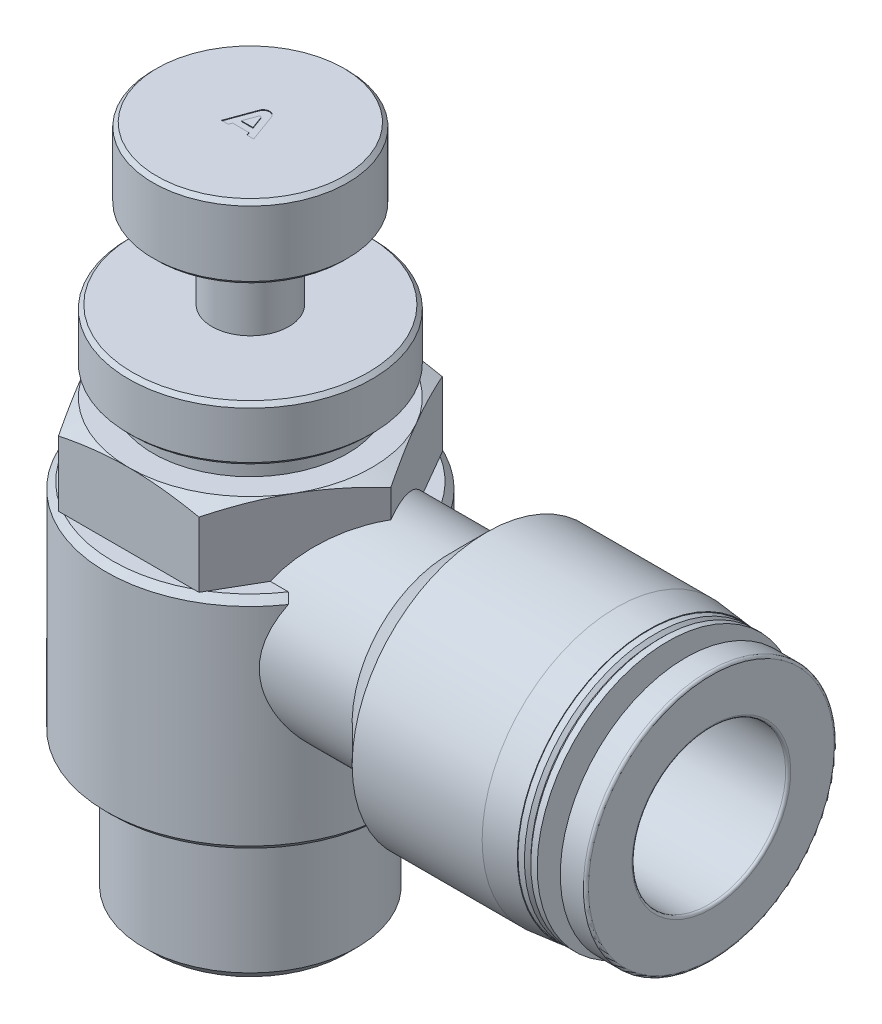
SolidWorks part; units mm, degrees
ref_plane "前视基准面" through (0, 0, 0) normal (0, 0, 1) x (1, 0, 0)
ref_plane "上视基准面" through (0, 0, 0) normal (0, 1, 0) x (1, 0, 0)
ref_plane "右视基准面" through (0, 0, 0) normal (1, 0, 0) x (0, 0, -1)
sketch "草图1" plane through (0, 0, 0) normal (0, 0, 1) x (1, 0, 0)
  line L0 (0, -23.5) -> (-7.475, -23.5)
  line L1 (-7.475, -23.5) -> (-8.331, -22.644)
  line L2 (-8.331, -22.644) -> (-8.331, -12.5)
  line L3 (-8.331, -12.5) -> (-10.75, -12.5)
  line L4 (-10.75, -12.5) -> (-11.25, -12)
  line L5 (-11.25, -12) -> (-11.25, 4.2)
  line L6 (-11.25, 4.2) -> (-10.75, 4.7)
  line L7 (-10.75, 4.7) -> (-10.9697, 4.7)
  line L8 (-10.9697, 4.7) -> (-10.9697, 9.7912)
  line L9 (-10.9697, 9.7912) -> (-9.5, 10.4)
  line L10 (-9.5, 10.4) -> (-7.6, 10.4)
  line L11 (-7.6, 10.4) -> (-7.6, 11.6)
  line L12 (-7.6, 11.6) -> (-7.3, 11.9)
  line L13 (-7.3, 11.9) -> (-3, 11.9)
  line L14 (-3, 11.9) -> (-3, 12.4)
  line L15 (-3, 12.4) -> (-9.2, 12.4)
  line L16 (-9.2, 12.4) -> (-9.5, 12.7)
  line L17 (-9.5, 12.7) -> (-9.5, 16.375)
  line L18 (-9.5, 16.375) -> (-9.2, 16.675)
  line L19 (-9.2, 16.675) -> (-3, 16.675)
  line L20 (-3, 16.675) -> (-3, 22.9935)
  line L21 (-3, 22.9935) -> (-2.6935, 23.3)
  line L22 (-2.6935, 23.3) -> (-7.3, 23.3)
  line L23 (-7.3, 23.3) -> (-7.6, 23.6)
  line L24 (-7.6, 23.6) -> (-7.6, 28.7)
  line L25 (-7.6, 28.7) -> (-7.3, 29)
  line L26 (-7.3, 29) -> (0, 29)
  line L27 (0, 29) -> (0, -23.5)
  line L28 (0, 29) -> (0, -23.5) construction
revolve "旋转1" add sketch "草图1" angle 360 about L28
ref_plane "基准面1" through (0, 4.7, 0) normal (0, 1, 0) x (1, 0, 0)
sketch "草图2" plane through (0, 4.7, 0) normal (0, 1, 0) x (1, 0, 0)
  line L0 (-10.9697, 0) -> (-5.4848, -9.5)
  line L1 (-5.4848, -9.5) -> (5.4848, -9.5)
  line L2 (5.4848, -9.5) -> (10.9697, 0)
  line L3 (10.9697, 0) -> (5.4848, 9.5)
  line L4 (5.4848, 9.5) -> (-5.4848, 9.5)
  line L5 (-5.4848, 9.5) -> (-10.9697, 0)
  circle A0 centre (0, 0) radius 19
extrude "切除-拉伸1" cut sketch "草图2" along normal blind 5.7
sketch "草图3" plane through (0, 0, 0) normal (0, 0, 1) x (1, 0, 0)
  line L0 (0, 7.6) -> (0, 4)
  line L1 (0, 4) -> (13, 4)
  line L2 (13, 4) -> (13, 6)
  line L3 (13, 6) -> (35.8, 6)
  line L4 (36, 6.2) -> (36, 9.6)
  line L5 (35.8, 9.8) -> (34, 9.8)
  line L6 (34, 9.8) -> (34, 6.9)
  line L7 (34, 6.9) -> (32.6, 6.9)
  line L8 (32.6, 6.9) -> (32.6, 10.2)
  line L9 (32.6, 10.2) -> (32.1, 10.2)
  line L10 (32.1, 10.2) -> (31.85, 9.95)
  line L11 (31.85, 9.95) -> (31.6, 10.2)
  line L12 (31.6, 10.2) -> (31.1, 10.2)
  line L13 (31.1, 10.2) -> (31.1, 10.25)
  line L14 (31.1, 10.25) -> (28.6, 10.5)
  line L15 (28.6, 10.5) -> (18.4497, 10.5)
  line L16 (18.4497, 10.5) -> (15.5497, 7.6)
  line L17 (15.5497, 7.6) -> (0, 7.6)
  line L18 (36, 0) -> (0, 0) construction
  arc A0 (35.8, 6) -> (36, 6.2) centre (35.8, 6.2) ccw
  arc A1 (36, 9.6) -> (35.8, 9.8) centre (35.8, 9.6) ccw
revolve "旋转2" add sketch "草图3" angle 360 about L18
sketch "草图4" plane through (0, 0, 0) normal (0, 0, 1) x (1, 0, 0)
  line L0 (0, -23.5) -> (-4.4655, -23.5)
  line L1 (-4.1655, -23.2) -> (-4.1655, 0)
  line L2 (-4.1655, 0) -> (-2.777, 0)
  line L3 (-2.777, 0) -> (-2.777, 2.777)
  line L4 (0, 5.554) -> (0, -23.5)
  line L5 (0, 5.554) -> (0, -23.5) construction
  arc A0 (-4.4655, -23.5) -> (-4.1655, -23.2) centre (-4.4655, -23.2) ccw
  arc A1 (-2.777, 2.777) -> (0, 5.554) centre (0, 2.777) cw
revolve "切除-旋转1" cut sketch "草图4" angle 360 about L5
sketch "草图5" plane through (0, 0, 0) normal (0, 0, 1) x (1, 0, 0)
  line L0 (0, 0) -> (0, 4)
  line L1 (0, 4) -> (13, 4)
  line L2 (13, 4) -> (13, 6)
  line L3 (13, 6) -> (36, 6)
  line L4 (36, 6) -> (36, 0)
  line L5 (36, 0) -> (0, 0)
  line L6 (36, 0) -> (0, 0) construction
revolve "切除-旋转2" cut sketch "草图5" angle 360 about L6
ref_plane "基准面2" through (0, 29, 0) normal (0, 1, 0) x (1, 0, 0)
sketch "草图6" plane through (0, 29, 0) normal (0, 1, 0) x (1, 0, 0)
  line L0 (-1.26, -1) -> (-0.7279, -1)
  line L1 (-0.7279, -1) -> (-0.6369, -0.75)
  line L2 (-0.6369, -0.75) -> (0.6369, -0.75)
  line L3 (0.6369, -0.75) -> (0.7279, -1)
  line L4 (0.7279, -1) -> (1.26, -1)
  line L5 (1.26, -1) -> (0.4698, 1.171)
  line L6 (-0.4698, 1.171) -> (-1.26, -1)
  line L7 (-0.455, -0.25) -> (0.455, -0.25)
  line L8 (0.455, -0.25) -> (0.094, 0.7418)
  line L9 (-0.094, 0.7418) -> (-0.455, -0.25)
  arc A0 (0.4698, 1.171) -> (-0.4698, 1.171) centre (0, 1) ccw
  arc A1 (0.094, 0.7418) -> (-0.094, 0.7418) centre (0, 0.7076) ccw
extrude "切除-拉伸2" cut sketch "草图6" against normal blind 0.05
